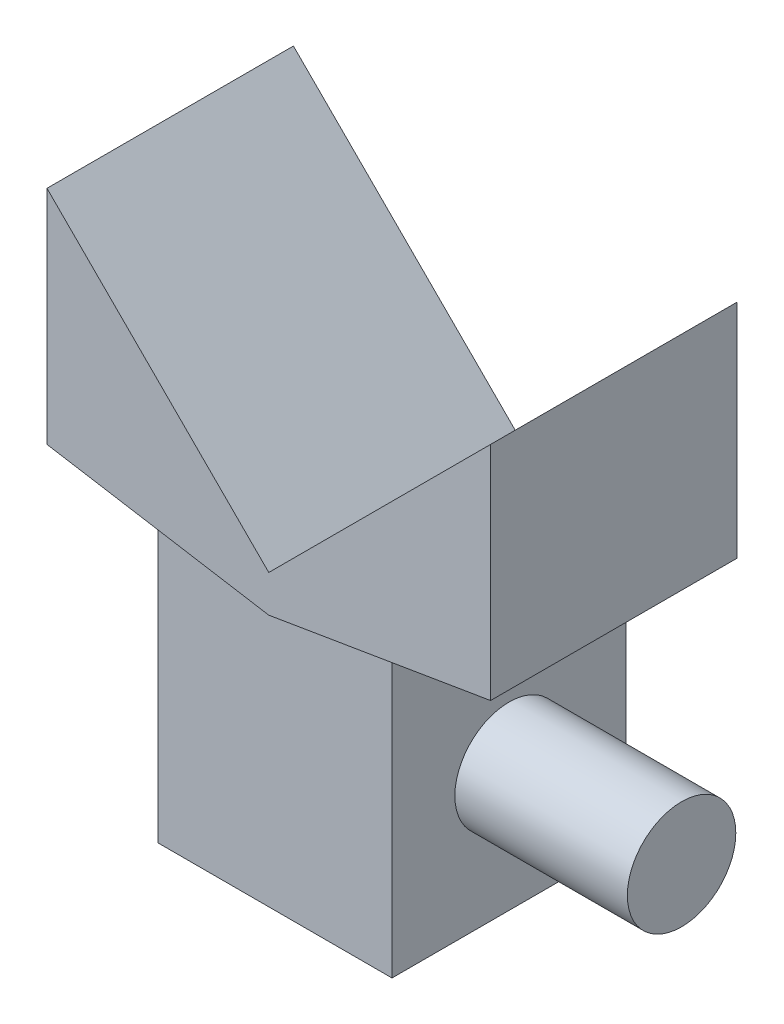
SolidWorks part; units mm, degrees
ref_plane "Front Plane" through (0, 0, 0) normal (0, 0, 1) x (1, 0, 0)
ref_plane "Top Plane" through (0, 0, 0) normal (0, 1, 0) x (1, 0, 0)
ref_plane "Right Plane" through (0, 0, 0) normal (1, 0, 0) x (0, 0, -1)
sketch "Sketch1" plane through (0, 0, 0) normal (0, 0, 1) x (1, 0, 0)
  line L1 (0, 0) -> (-9, 9)
  line L3 (-9, 0) -> (-9, 9)
  line L13 (0, 0) -> (9, 9)
  line L14 (9, 9) -> (9, 0)
  line L17 (-9, 0) -> (0, -1.5)
  line L18 (9, 0) -> (0, -1.5)
extrude "Boss-Extrude5" add sketch "Sketch1" along normal blind 10 contours L17 L18 L14 L13 L1 L3
ref_plane "Plane1" through (0, -12, 0) normal (0, 1, 0) x (1, 0, 0)
sketch "Sketch2" plane through (0, -12, 0) normal (0, 1, 0) x (1, 0, 0)
  line L0 (0, -10) -> (0, 0) construction
  line L1 (-4.75, -0.25) -> (4.75, -0.25)
  line L2 (-4.75, -0.25) -> (-4.75, -9.75)
  line L3 (-4.75, -9.75) -> (4.75, -9.75)
  line L4 (4.75, -0.25) -> (4.75, -9.75)
  line L5 (-4.75, -0.25) -> (4.75, -9.75) construction
  line L6 (-4.75, -9.75) -> (4.75, -0.25) construction
  point P0 (0, -5)
  dimension "D1" = 9.5
  dimension "D2" = 9.5
extrude "Boss-Extrude6" add sketch "Sketch2" along normal up to body
sketch "Sketch5" plane through (4.75, 0, 0) normal (1, 0, 0) x (0, 0, -1)
  circle A0 centre (-4.9999, -6.8776) radius 2.2
  dimension "D1" = 4.4
extrude "Boss-Extrude7" add sketch "Sketch5" along normal blind 7
